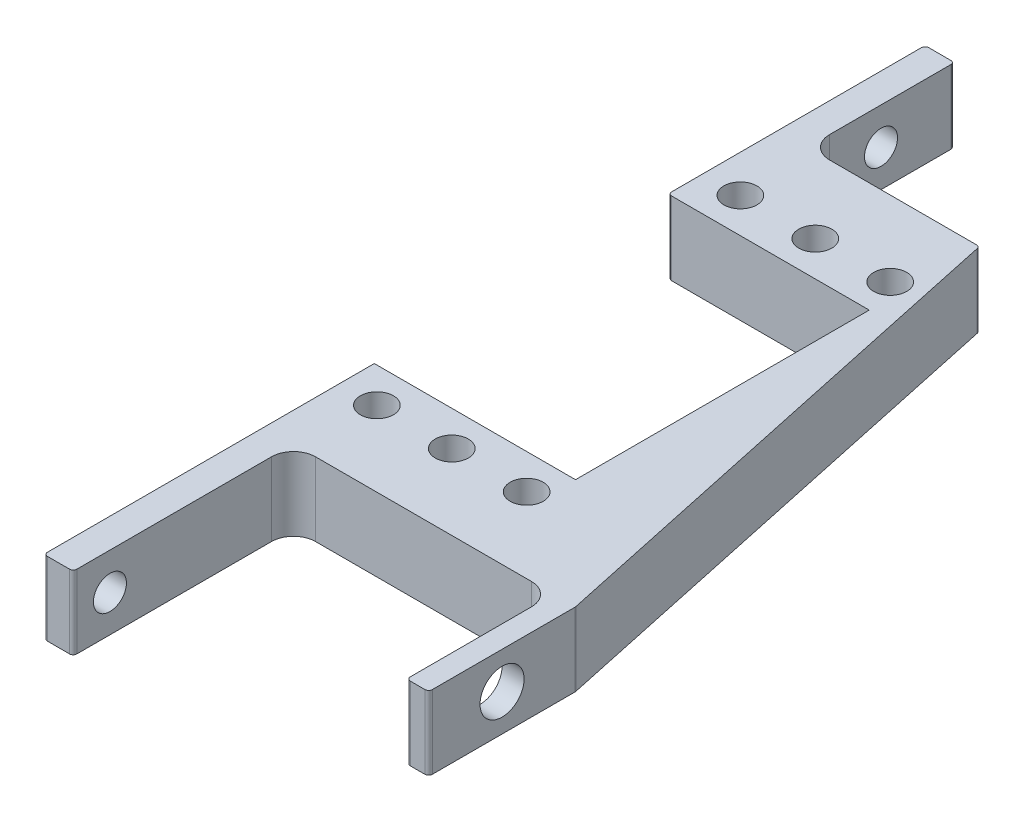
SolidWorks part; units mm, degrees
ref_plane "Front Plane" through (0, 0, 0) normal (0, 0, 1) x (1, 0, 0)
ref_plane "Top Plane" through (0, 0, 0) normal (0, 1, 0) x (1, 0, 0)
ref_plane "Right Plane" through (0, 0, 0) normal (1, 0, 0) x (0, 0, -1)
sketch "Sketch2" plane through (0, 0, 0) normal (0, 1, 0) x (1, 0, 0)
  line L0 (0, 0) -> (15, 0)
  line L1 (15, 0) -> (15, 20)
  line L2 (15, 20) -> (0.0056, 90.0021)
  line L3 (0, 0) -> (0, 20.0021)
  line L4 (0.0056, 90.0021) -> (-27.4, 90.0021)
  line L10 (-27.4, 20.0021) -> (0, 20.0021)
  line L12 (-27.4, 90.0021) -> (-27.4, 75.0021)
  line L21 (0, 35.0021) -> (-27.4, 35.0021)
  line L22 (0, 35.0021) -> (0, 75.0021)
  line L23 (0, 75.0021) -> (-27.4, 75.0021)
  line L27 (-27.4, 35.0021) -> (-27.4, 20.0021)
  dimension "D1" = 15
  dimension "D2" = 20
  dimension "D3" = 71.59
  dimension "D4" = 167.91
  dimension "D5" = 15
  dimension "D6" = 15
  dimension "D9" = 15
  dimension "D10" = 27.4
extrude "Boss-Extrude1" add sketch "Sketch2" along normal blind 10
sketch "Sketch4" plane through (0, 10, 0) normal (0, 1, 0) x (1, 0, 0)
  line L0 (0, 75.0021) -> (0, 35.0021) construction
  line L1 (0, 35.0021) -> (-27.4, 35.0021) construction
  circle A0 centre (-1.9, 30.2521) radius 2.25
  dimension "D1" = 4.5
  dimension "D2" = 1.9
  dimension "D3" = 4.75
extrude "Cut-Extrude2" cut sketch "Sketch4" against normal blind 24 contours A0
pattern_linear "LPattern2" count 3 spacing 10.2 along (-1, 0, 0) of "Cut-Extrude2"
sketch "Sketch5" plane through (0, 0, -90.0021) normal (0, 0, -1) x (-1, 0, 0)
  line L0 (55, 0) -> (-55, 0) construction
  line L1 (27.4, 10) -> (15.4, 10)
  line L2 (27.4, 10) -> (27.4, 0)
  line L3 (27.4, 0) -> (15.4, 0)
  line L4 (15.4, 10) -> (15.4, 0)
  dimension "D1" = 12
extrude "Boss-Extrude2" add sketch "Sketch5" along normal blind 20
sketch "Sketch6" plane through (-15.4, 0, 0) normal (1, 0, 0) x (0, 0, -1)
  line L0 (90.0021, 10) -> (110.0021, 0) construction
  line L1 (55, 0) -> (-55, 0) construction
  line L2 (110.0021, 10) -> (90.0021, 0) construction
  line L3 (90.0021, 10) -> (90.0021, 0) construction
  circle A0 centre (100.0021, 5) radius 2.25
  dimension "D1" = 4.5
extrude "Cut-Extrude3" cut sketch "Sketch6" against normal blind 20
sketch "Sketch7" plane through (0, 0, -20.0021) normal (0, 0, 1) x (1, 0, 0)
  line L0 (55, 0) -> (-55, 0) construction
  line L1 (-27.4, 10) -> (-15.4, 10)
  line L2 (-27.4, 10) -> (-27.4, 0)
  line L3 (-27.4, 0) -> (-15.4, 0)
  line L4 (-15.4, 10) -> (-15.4, 0)
  dimension "D1" = 12
extrude "Boss-Extrude3" add sketch "Sketch7" along normal blind 30
sketch "Sketch8" plane through (-15.4, 0, 0) normal (1, 0, 0) x (0, 0, -1)
  line L0 (-9.9979, 10) -> (0, 10) construction
  line L2 (0, 10) -> (-9.9979, 0) construction
  line L3 (55, 0) -> (-55, 0) construction
  line L4 (-9.9979, 0) -> (-9.9979, 10) construction
  line L5 (-9.9979, 0) -> (0, 0) construction
  line L6 (0, 0) -> (-9.9979, 10) construction
  circle A1 centre (-4.9989, 5) radius 2.25
  dimension "D1" = 4.5
extrude "Cut-Extrude4" cut sketch "Sketch8" against normal blind 20
ref_plane "Plane1" through (0, 0, -55.0021) normal (0, 0, -1) x (-1, 0, 0)
mirror "Mirror1" about plane through (0, 0, -55.0021) normal (0, 0, -1) of "LPattern2", "Cut-Extrude2"
sketch "Sketch9" plane through (0, 0, 0) normal (-1, 0, 0) x (0, 0, 1)
  line L0 (0, 10) -> (-20.0021, 10)
  line L1 (-20.0021, 10) -> (-20.0021, 0)
  line L2 (-20.0021, 0) -> (0, 0)
  line L3 (0, 0) -> (0, 10)
extrude "Cut-Extrude5" cut sketch "Sketch9" against normal blind 12
sketch "Sketch10" plane through (15, 0, 0) normal (1, 0, 0) x (0, 0, -1)
  line L0 (0, 10) -> (0, 0) construction
  line L1 (0, 0) -> (20, 10) construction
  line L2 (0, 10) -> (20, 0) construction
  line L3 (23.32, 0) -> (-23.32, 0) construction
  circle A0 centre (10, 5) radius 3
  dimension "D1" = 6
extrude "Cut-Extrude6" cut sketch "Sketch10" against normal blind 12
sketch "Sketch11" plane through (-15.4, 0, 0) normal (1, 0, 0) x (0, 0, -1)
  line L0 (-9.9979, 10) -> (20.0021, 10)
  line L1 (20.0021, 10) -> (20.0021, 0)
  line L2 (20.0021, 0) -> (-9.9979, 0)
  line L3 (-9.9979, 0) -> (-9.9979, 10)
extrude "Cut-Extrude7" cut sketch "Sketch11" against normal blind 8
sketch "Sketch12" plane through (-15.4, 0, 0) normal (1, 0, 0) x (0, 0, -1)
  line L0 (90.0021, 10) -> (110.0021, 10)
  line L1 (110.0021, 10) -> (110.0021, 0)
  line L2 (23.32, 0) -> (-23.32, 0) construction
  line L3 (110.0021, 0) -> (90.0021, 0)
  line L4 (90.0021, 0) -> (90.0021, 10)
extrude "Cut-Extrude8" cut sketch "Sketch12" against normal blind 8
fillet "Fillet1" radius 3 3 edges at (-23.4, 5, -90.0021) (12, 5, -20.0021) (-23.4, 5, -20.0021)
fillet "Fillet2" radius 0.5 9 edges at (15, 5, -20) (0.0056, 5, -90.0021) (-23.4, 5, -110.0021) (-27.4, 5, -110.0021) (-27.4, 5, -75.0021) (15, 5, 0) (12, 5, 0) (-27.4, 5, 9.9979) (-23.4, 5, 9.9979)
